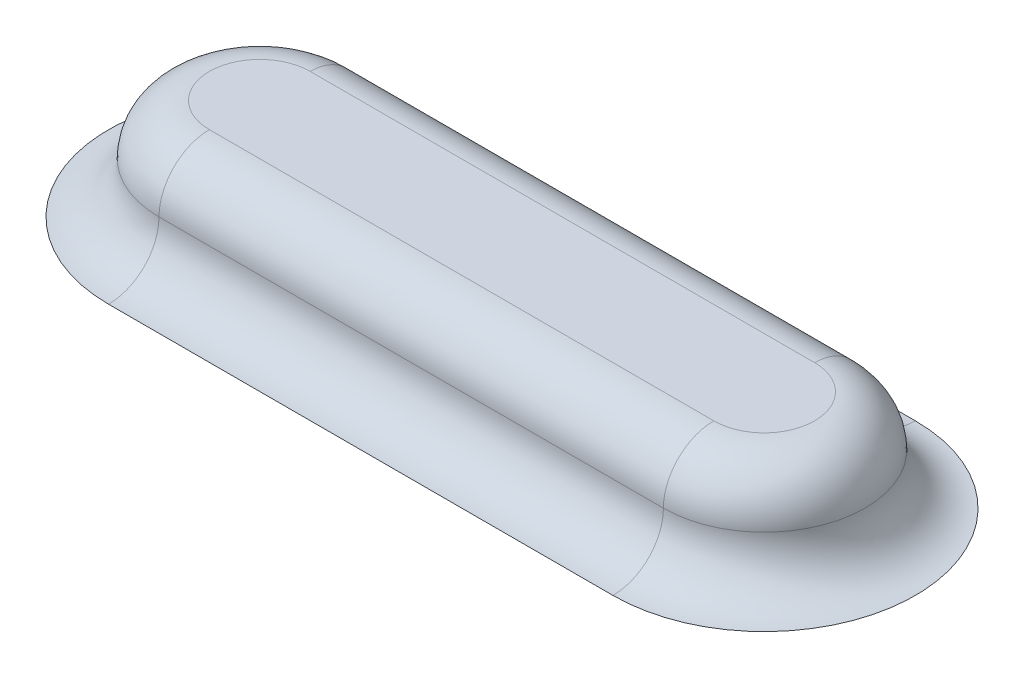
SolidWorks part; units mm, degrees
ref_plane "Front" through (0, 0, 0) normal (0, 0, 1) x (1, 0, 0)
ref_plane "Top" through (0, 0, 0) normal (0, 1, 0) x (1, 0, 0)
ref_plane "Right" through (0, 0, 0) normal (1, 0, 0) x (0, 0, -1)
sketch "Sketch1" plane through (0, 0, 0) normal (0, 1, 0) x (1, 0, 0)
  line L1 (-120.8151, 90.7929) -> (137.2789, 90.7929)
  line L2 (-120.8151, 90.7929) -> (-120.8151, -99.9932)
  line L3 (-120.8151, -99.9932) -> (137.2789, -99.9932)
  line L4 (137.2789, 90.7929) -> (137.2789, -99.9932)
extrude "Extrude1" add sketch "Sketch1" along normal blind 31.496
sketch "Sketch2" plane through (0, 31.496, 0) normal (0, 1, 0) x (-1, 0, 0)
  line L0 (37.111, 0) -> (-26.4339, 0) construction
  line L1 (37.111, 12.7) -> (-26.4339, 12.7)
  line L2 (37.111, -12.7) -> (-26.4339, -12.7)
  arc A0 (37.111, 12.7) -> (37.111, -12.7) centre (37.111, 0) cw
  arc A1 (-26.4339, 12.7) -> (-26.4339, -12.7) centre (-26.4339, 0) ccw
  dimension "D1" = 12.7
  dimension "D2" = 12.7
extrude "Extrude2" add sketch "Sketch2" along normal blind 12.7
fillet "Fillet1" radius 6.35 8 edges at (-49.811, 44.196, 0) (-5.3386, 44.196, -12.7) (39.1339, 44.196, 0) (-49.811, 31.496, 0) (-5.3386, 31.496, -12.7) (39.1339, 31.496, 0) (-5.3386, 44.196, 12.7) (-5.3386, 31.496, 12.7)
sketch "Sketch3" plane through (0, 31.496, 0) normal (0, 1, 0) x (-1, 0, 0)
  line L4 (120.8151, -90.7929) -> (120.8151, 99.9932)
  line L5 (120.8151, 99.9932) -> (-137.2789, 99.9932)
  line L6 (-137.2789, 99.9932) -> (-137.2789, -90.7929)
  line L7 (-137.2789, -90.7929) -> (120.8151, -90.7929)
  line L8 (120.8151, -90.7929) -> (120.8151, 99.9932)
  line L9 (120.8151, 99.9932) -> (-137.2789, 99.9932)
  line L10 (-137.2789, 99.9932) -> (-137.2789, -90.7929)
  line L11 (-137.2789, -90.7929) -> (120.8151, -90.7929)
  dimension "D1" = 0
extrude "Cut-Extrude1" cut sketch "Sketch3" against normal through all
